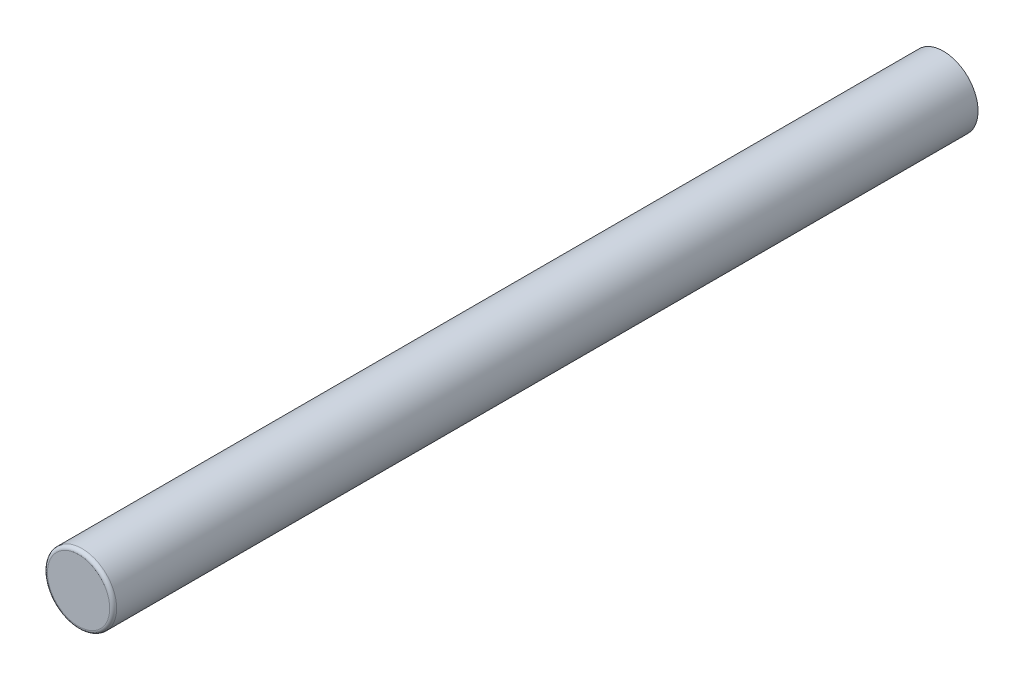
SolidWorks part; units mm, degrees
ref_plane "Face" through (0, 0, 0) normal (0, 0, 1) x (1, 0, 0)
ref_plane "Dessus" through (0, 0, 0) normal (0, 1, 0) x (1, 0, 0)
ref_plane "Droite" through (0, 0, 0) normal (1, 0, 0) x (0, 0, -1)
sketch "Esquisse1" plane through (0, 0, 0) normal (0, 0, 1) x (1, 0, 0)
  circle A0 centre (0, 0) radius 1
  dimension "D1" = 2
extrude "Cylindre de base" add sketch "Esquisse1" along normal mid plane 25
fillet "Congé1" radius 0.1
